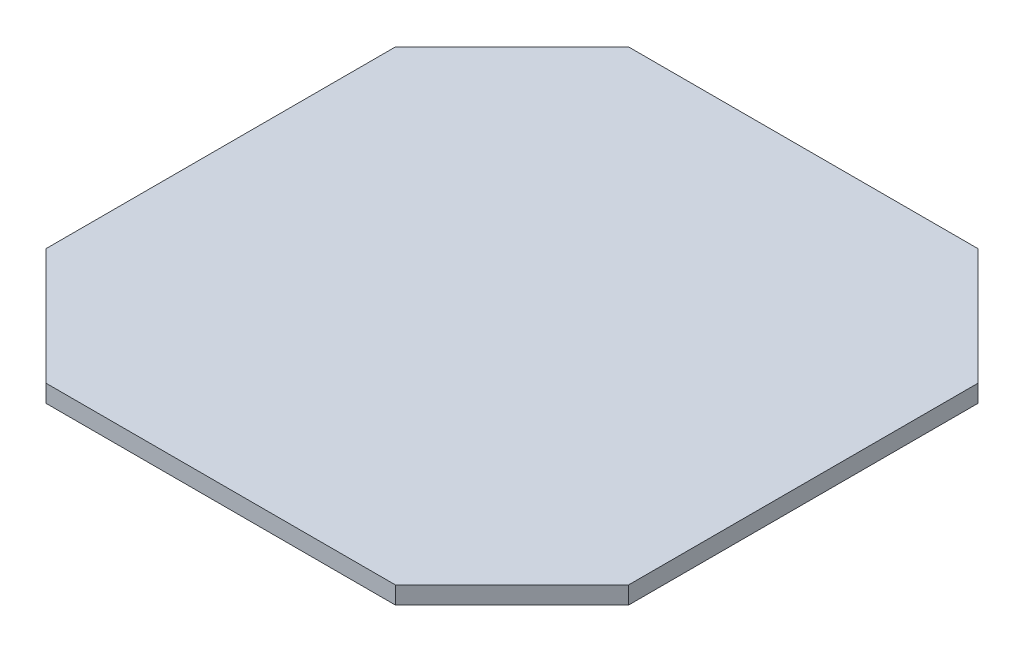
SolidWorks part; units mm, degrees
ref_plane "Front Plane" through (0, 0, 0) normal (0, 0, 1) x (1, 0, 0)
ref_plane "Top Plane" through (0, 0, 0) normal (0, 1, 0) x (1, 0, 0)
ref_plane "Right Plane" through (0, 0, 0) normal (1, 0, 0) x (0, 0, -1)
sketch "Sketch2" plane through (0, 0, 0) normal (0, 1, 0) x (1, 0, 0)
  line L1 (-63.5, 63.5) -> (63.5, 63.5)
  line L2 (-63.5, 63.5) -> (-63.5, -63.5)
  line L3 (-63.5, -63.5) -> (63.5, -63.5)
  line L4 (63.5, 63.5) -> (63.5, -63.5)
  point P4 (0, 63.5)
  point P6 (63.5, 0)
  dimension "D1" = 127
  dimension "D2" = 127
extrude "Boss-Extrude1" add sketch "Sketch2" along normal blind 3.81
chamfer "Chamfer1" distance 25.4 angle 45 4 edges at (-63.5, 1.905, 63.5) (63.5, 1.905, 63.5) (63.5, 1.905, -63.5) (-63.5, 1.905, -63.5)
